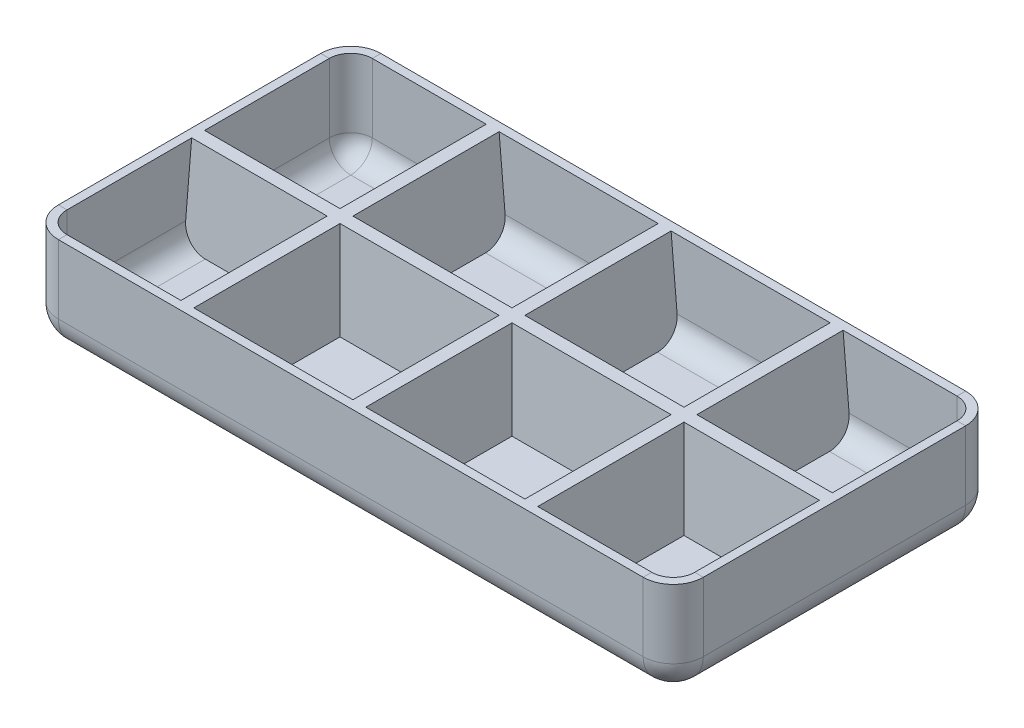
SolidWorks part; units mm, degrees
ref_plane "Front Plane" through (0, 0, 0) normal (0, 0, 1) x (1, 0, 0)
ref_plane "Top Plane" through (0, 0, 0) normal (0, 1, 0) x (1, 0, 0)
ref_plane "Right Plane" through (0, 0, 0) normal (1, 0, 0) x (0, 0, -1)
sketch "Sketch1" plane through (0, 0, 0) normal (0, 1, 0) x (1, 0, 0)
  line L1 (0, 0) -> (150, 0)
  line L2 (0, 0) -> (0, 75)
  line L3 (0, 75) -> (150, 75)
  line L4 (150, 0) -> (150, 75)
  dimension "D1" = 150
  dimension "D2" = 75
extrude "Extrude1" add sketch "Sketch1" along normal blind 30
fillet "Fillet1" radius 7 12 edges at (0, 15, 0) (150, 15, 0) (150, 15, -75) (0, 15, -75) (75, 30, -75) (150, 30, -37.5) (75, 30, 0) (0, 30, -37.5) (75, 0, 0) (150, 0, -37.5) (75, 0, -75) (0, 0, -37.5)
shell "Shell1" thickness 2
sketch "Sketch2" plane through (0, 23, 0) normal (0, 1, 0) x (-1, 0, 0)
  line L0 (-75, -75) -> (-75, 0)
  line L7 (-7, -75) -> (-143, -75) construction
  line L9 (-143, 0) -> (-7, 0) construction
  line L10 (0, -37.5) -> (-150, -37.5)
  line L11 (0, -7) -> (0, -68) construction
  line L12 (-150, -68) -> (-150, -7) construction
  line L13 (-115, -75) -> (-115, 0)
  line L14 (-35, -75) -> (-35, 0)
  dimension "D1" = 40
  dimension "D2" = 40
rib "Rib1" sketch "Sketch2" sketch "Sketch2" thickness 3 extrusion direction normal to sketch draft on yes draft angle 5 parameters "D1"=3, "D3"=5
